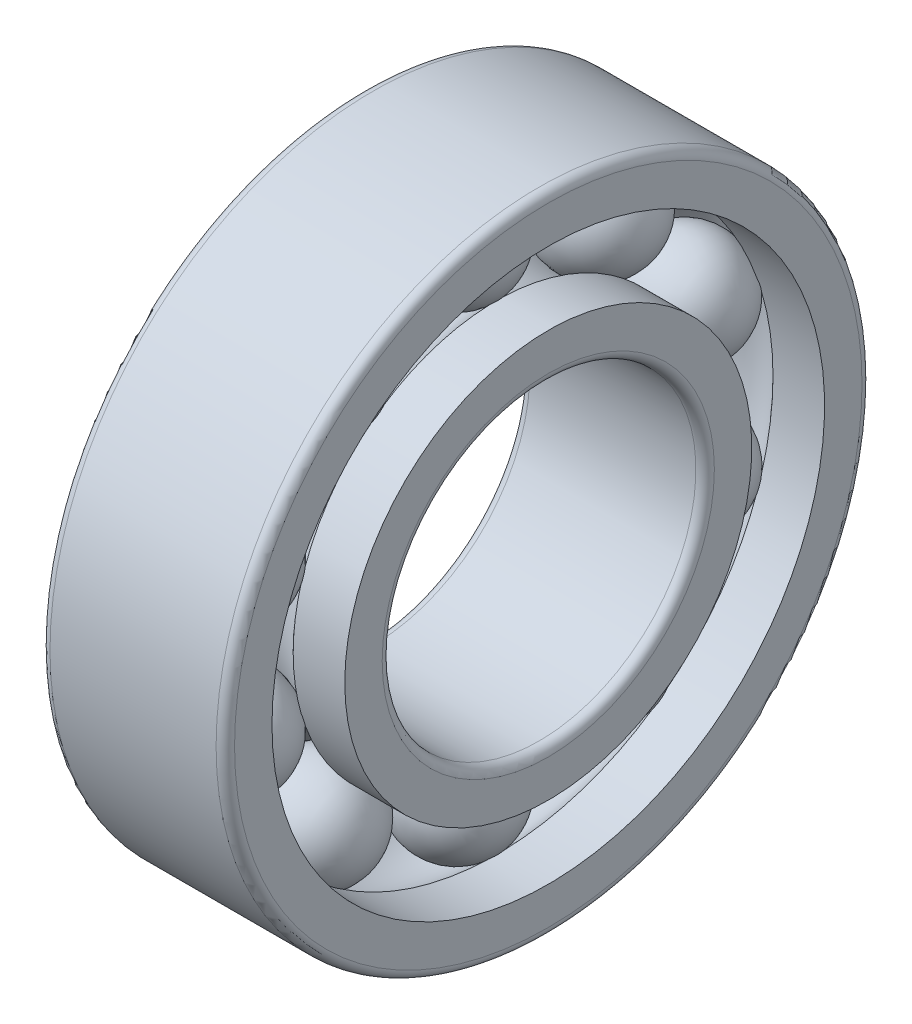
SolidWorks part; units mm, degrees
ref_plane "Plan1" through (0, 0, 0) normal (0, 0, 1) x (1, 0, 0)
ref_plane "Plan2" through (0, 0, 0) normal (0, 1, 0) x (1, 0, 0)
ref_plane "Plan3" through (0, 0, 0) normal (1, 0, 0) x (0, 0, -1)
sketch "Esquisse1" plane through (0, 0, 0) normal (0, 0, 1) x (1, 0, 0)
  line L0 (0, 0) -> (10, 0) construction
  line L1 (0, 8.5) -> (0, -8.5) construction
  line L2 (7.2052, 11.0276) -> (10, 11.0276)
  line L3 (0, 9) -> (0, 11.0276)
  line L4 (0, 17.5) -> (0, -17.5) construction
  line L5 (10, 11.0276) -> (10, 9)
  line L6 (9.5, 8.5) -> (0.5, 8.5)
  line L7 (0, 10.0414) -> (10, 10.0414) construction
  line L8 (0, 11.0276) -> (2.7948, 11.0276)
  arc A0 (2.7948, 11.0276) -> (7.2052, 11.0276) centre (5, 13) ccw
  arc A1 (0.5, 8.5) -> (0, 9) centre (0.5, 9) cw
  arc A2 (10, 9) -> (9.5, 8.5) centre (9.5, 9) cw
  dimension "D1" = 13
  dimension "D bille" = 5.9172
  dimension "Rayon" = 0.5
  dimension "D3" = 0.9862
  dimension "Epaisseur" = 10
  dimension "Diamètre int" = 17
  dimension "D2" = 5
  dimension "Diamètre ext" = 35
revolve "Bague int" add sketch "Esquisse1" angle 360 about L0
sketch "Esquisse3" plane through (0, 0, 0) normal (0, 0, 1) x (1, 0, 0)
  line L1 (2.0164, 13) -> (7.9836, 13) construction
  line L2 (2.0164, 13) -> (7.9836, 13)
  arc A0 (2.0164, 13) -> (7.9836, 13) centre (5, 13) ccw
  dimension "D1" = 5.9672
  dimension "D2" = 13
  dimension "D3" = 5
revolve "Bille" add sketch "Esquisse3" angle 360 about L1
sketch "Esquisse2" plane through (0, 0, 0) normal (0, 0, 1) x (1, 0, 0)
  line L0 (0, 15.9586) -> (10, 15.9586) construction
  line L1 (0.5, 17.5) -> (9.5, 17.5)
  line L2 (0, 17) -> (0, 14.9724)
  line L3 (0, 14.9724) -> (2.7948, 14.9724)
  line L4 (10, 17) -> (10, 14.9724)
  line L5 (7.2052, 14.9724) -> (10, 14.9724)
  line L6 (10, -11.0276) -> (10, 11.0276) construction
  line L8 (0, 14.9724) -> (0, -14.9724) construction
  line L9 (0, 17.5) -> (0, -17.5) construction
  line L11 (0, 0) -> (10, 0) construction
  line L12 (0, 0) -> (10, 0) construction
  arc A0 (10, 17) -> (9.5, 17.5) centre (9.5, 17) ccw
  arc A1 (0.5, 17.5) -> (0, 17) centre (0.5, 17) ccw
  circle A2 centre (5, 13) radius 2.9586 construction
  arc A4 (7.2052, 14.9724) -> (2.7948, 14.9724) centre (5, 13) ccw
  dimension "Rayon" = 0.5
  dimension "D2" = 5
  dimension "D bille" = 5.9172
  dimension "D3" = 0.9862
  dimension "Diamètre ext" = 35
  dimension "D1" = 13
revolve "Bague ext" add sketch "Esquisse2" angle 360 about L11
pattern_circular "Nbr de billes" count 10 every 36 about axis through (0, 0, 0) along (1, 0, 0)
equation "\"D2@Esquisse1\" = \"Epaisseur@Esquisse1\"/2"
equation "\"D bille@Esquisse1\" = \"Epaisseur@Esquisse1\"/1.69"
equation "\"D3@Esquisse1\" = \"D bille@Esquisse1\"/6"
equation "\"D1@Esquisse1\" = ((\"Diamètre ext@Esquisse1\"-\"Diamètre int@Esquisse1\")/4)+(\"Diamètre int@Esquisse1\"/2)"
equation "\"D3@Esquisse3\" = \"D2@Esquisse1\""
equation "\"D1@Esquisse3\" = \"D bille@Esquisse1\"+0.05"
equation "\"D2@Esquisse2\" = \"D2@Esquisse1\""
equation "\"D1@Esquisse2\" = \"D1@Esquisse1\""
equation "\"D bille@Esquisse2\" = \"D bille@Esquisse1\""
equation "\"D3@Esquisse2\" = \"D3@Esquisse1\""
equation "\"D2@Esquisse3\" = \"D1@Esquisse1\""
equation "\"D2@Nbr de billes\" = 360/\"Nbr de billes@Nbr de billes\""
